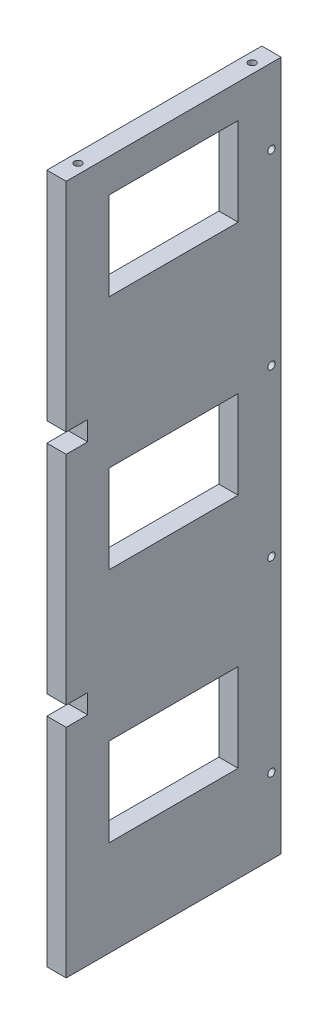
SolidWorks part; units mm, degrees
ref_plane "Front Plane" through (0, 0, 0) normal (0, 0, 1) x (1, 0, 0)
ref_plane "Top Plane" through (0, 0, 0) normal (0, 1, 0) x (1, 0, 0)
ref_plane "Right Plane" through (0, 0, 0) normal (1, 0, 0) x (0, 0, -1)
body saved out of another part "Stock-V1-1"
move or copy body "Body-Move/Copy1" bodies to move or copy 101 copy no rotation origin (-39.5, 0, 100) rotation axis (0, 1, 0) rotation angle 180
other "Move Face1" parameters "D1"=0.75
